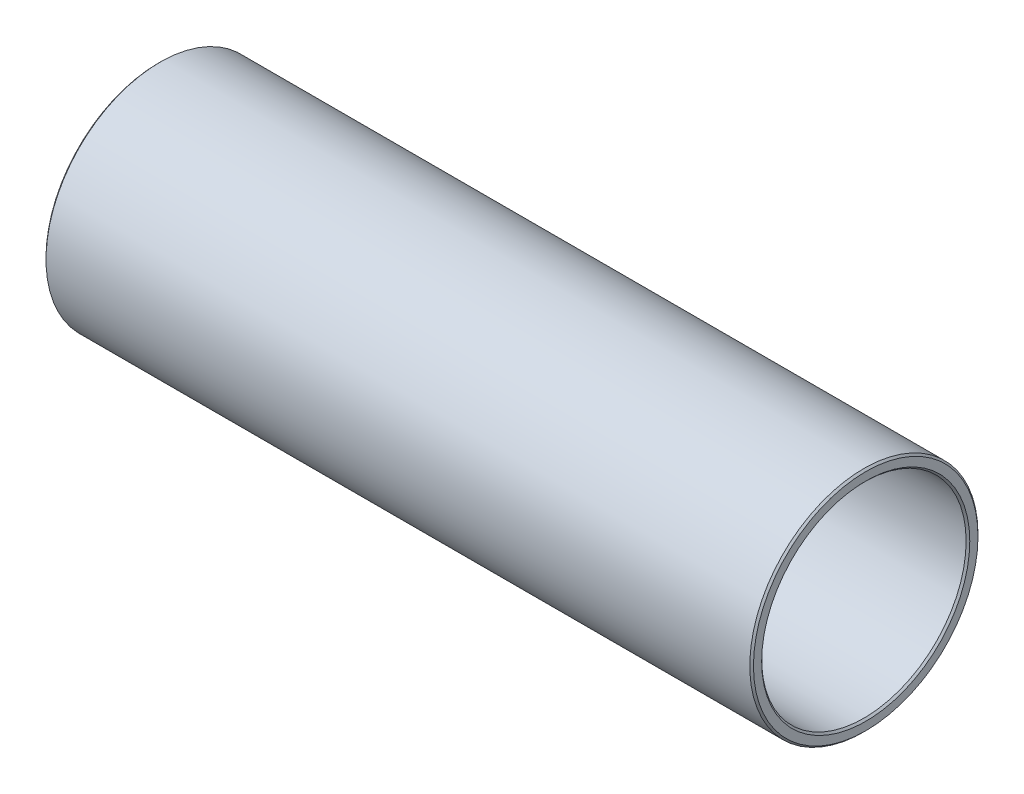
SolidWorks part; units mm, degrees
ref_plane "Front Plane" through (0, 0, 0) normal (0, 0, 1) x (1, 0, 0)
ref_plane "Top Plane" through (0, 0, 0) normal (0, 1, 0) x (1, 0, 0)
ref_plane "Right Plane" through (0, 0, 0) normal (1, 0, 0) x (0, 0, -1)
sketch "Sketch1" plane through (0, 0, 0) normal (1, 0, 0) x (0, 0, -1)
  circle A0 centre (0, 0) radius 15.875
  circle A1 centre (0, 0) radius 14.224
  dimension "D1" = 31.75
  dimension "D2" = 1.651
extrude "1 1/4\" x .065 tube" add sketch "Sketch1" along normal blind 98.425
chamfer "Chamfer1" distance 0.254 angle 45 4 edges at (0, 0, -14.224) (0, 0, -15.875) (98.425, 0, -14.224) (98.425, 0, -15.875)
